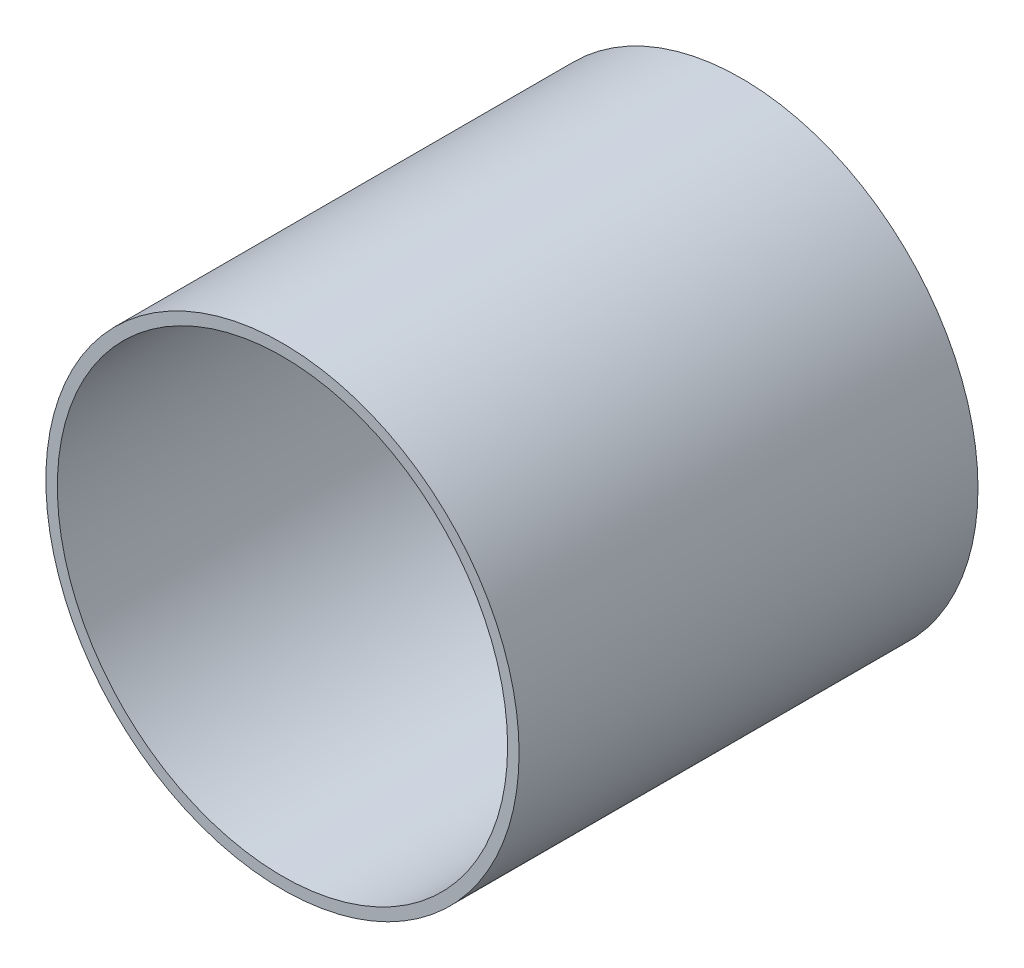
SolidWorks part; units mm, degrees
ref_plane "Plan de face" through (0, 0, 0) normal (0, 0, 1) x (1, 0, 0)
ref_plane "Plan de dessus" through (0, 0, 0) normal (0, 1, 0) x (1, 0, 0)
ref_plane "Plan de droite" through (0, 0, 0) normal (1, 0, 0) x (0, 0, -1)
sketch "Esquisse1" plane through (0, 0, 0) normal (0, 0, 1) x (1, 0, 0)
  circle A0 centre (0, 0) radius 82.5
  circle A1 centre (0, 0) radius 78.5
  dimension "D1" = 165
  dimension "D2" = 157
extrude "Boss.-Extru.1" add sketch "Esquisse1" along normal blind 160
